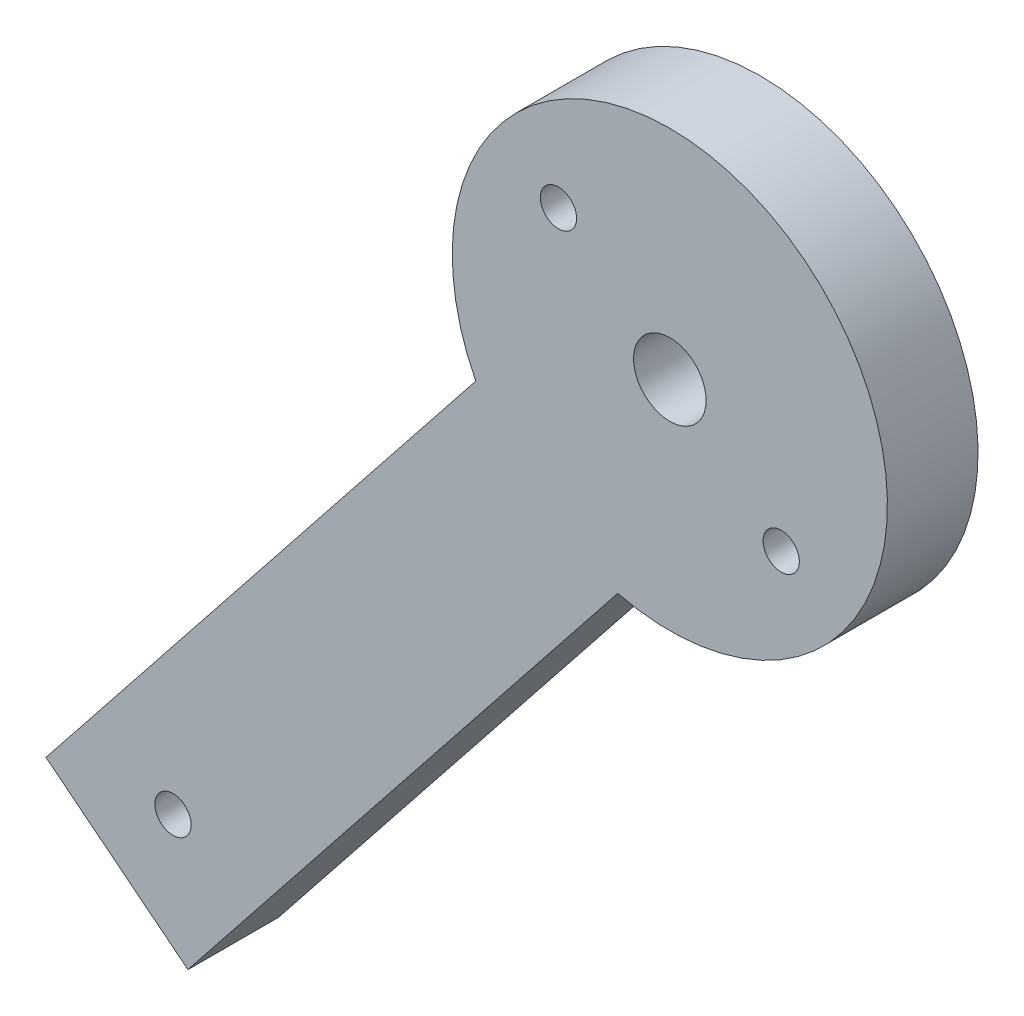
SolidWorks part; units mm, degrees
ref_plane "Front Plane" through (0, 0, 0) normal (0, 0, 1) x (1, 0, 0)
ref_plane "Top Plane" through (0, 0, 0) normal (0, 1, 0) x (1, 0, 0)
ref_plane "Right Plane" through (0, 0, 0) normal (1, 0, 0) x (0, 0, -1)
sketch "Sketch1" plane through (0, 0, 0) normal (0, 0, 1) x (1, 0, 0)
  line L0 (0.5558, 0) -> (8.702, 0) construction
  line L1 (0, 0) -> (-4.6097, -5.7997) construction
  line L3 (-10.7018, -5.4288) -> (-34.4027, -35.2484)
  line L4 (-34.4027, -35.2484) -> (-26.5743, -41.4706)
  line L5 (-26.5743, -41.4706) -> (-2.8733, -11.6509)
  arc A0 (-2.8733, -11.6509) -> (-10.7018, -5.4288) centre (0, 0) ccw
  dimension "D1" = 231.522
extrude "Boss-Extrude1" add sketch "Sketch1" along normal blind 5
sketch "Sketch2" plane through (0, 0, 5) normal (0, 0, 1) x (1, 0, 0)
  line L0 (0, 0) -> (-30.4885, -38.3595) construction
  line L1 (-34.4027, -35.2484) -> (-26.5743, -41.4706) construction
  circle A0 centre (0, 0) radius 2
  circle A1 centre (-27.398, -34.4711) radius 1
  dimension "D1" = 44.033
extrude "Cut-Extrude1" cut sketch "Sketch2" against normal blind 5
sketch "Sketch3" plane through (0, 0, 5) normal (0, 0, 1) x (1, 0, 0)
  line L0 (0, 0) -> (9.7518, 0) construction
  line L1 (0, 0) -> (5.3325, -4.4508) construction
  line L2 (0, 0) -> (-5.3662, 4.4789) construction
  circle A0 centre (6.1418, -5.1262) radius 1
  circle A1 centre (-6.1418, 5.1262) radius 1
  circle A2 centre (0, 0) radius 2 construction
  dimension "D3" = 8
  dimension "D4" = 8
  dimension "D1" = 39.85
  dimension "D2" = 180
extrude "Cut-Extrude2" cut sketch "Sketch3" against normal blind 5
sketch "Sketch4" plane through (0, 0, 5) normal (0, 0, 1) x (1, 0, 0)
  line L0 (0, 0) -> (10.6345, 0)
